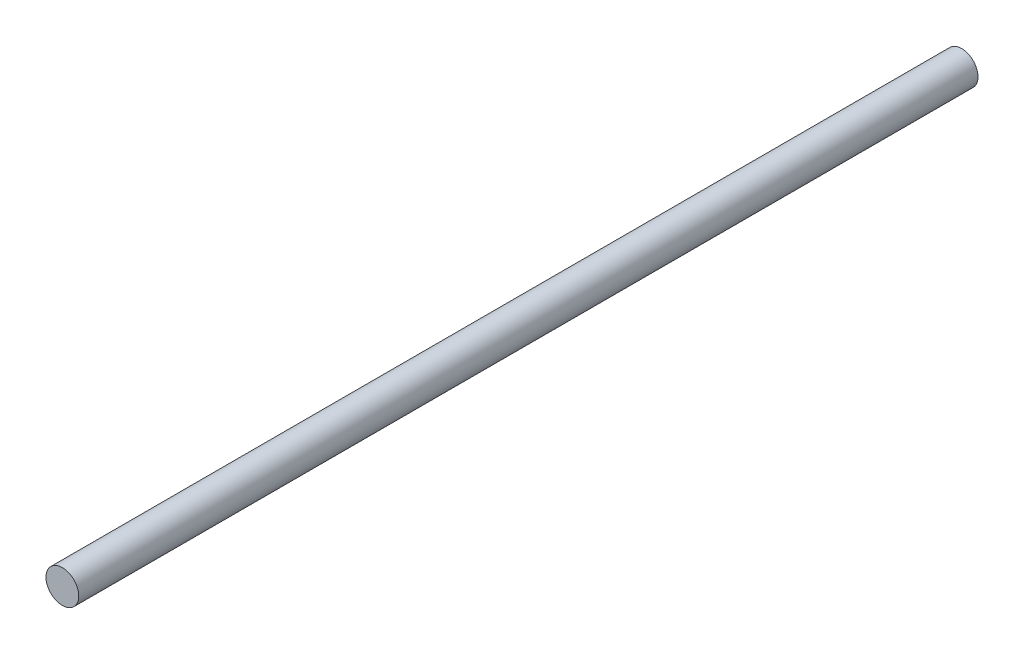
SolidWorks part; units mm, degrees
ref_plane "Front Plane" through (0, 0, 0) normal (0, 0, 1) x (1, 0, 0)
ref_plane "Top Plane" through (0, 0, 0) normal (0, 1, 0) x (1, 0, 0)
ref_plane "Right Plane" through (0, 0, 0) normal (1, 0, 0) x (0, 0, -1)
imported_body "Imported1"
sketch "Sketch1" plane through (0, 0, 85) normal (0, 0, 1) x (1, 0, 0)
  circle A0 centre (0, 0) radius 1.55
  dimension "D1" = 3.1
extrude "Boss-Extrude1" add sketch "Sketch1" against normal blind 85
